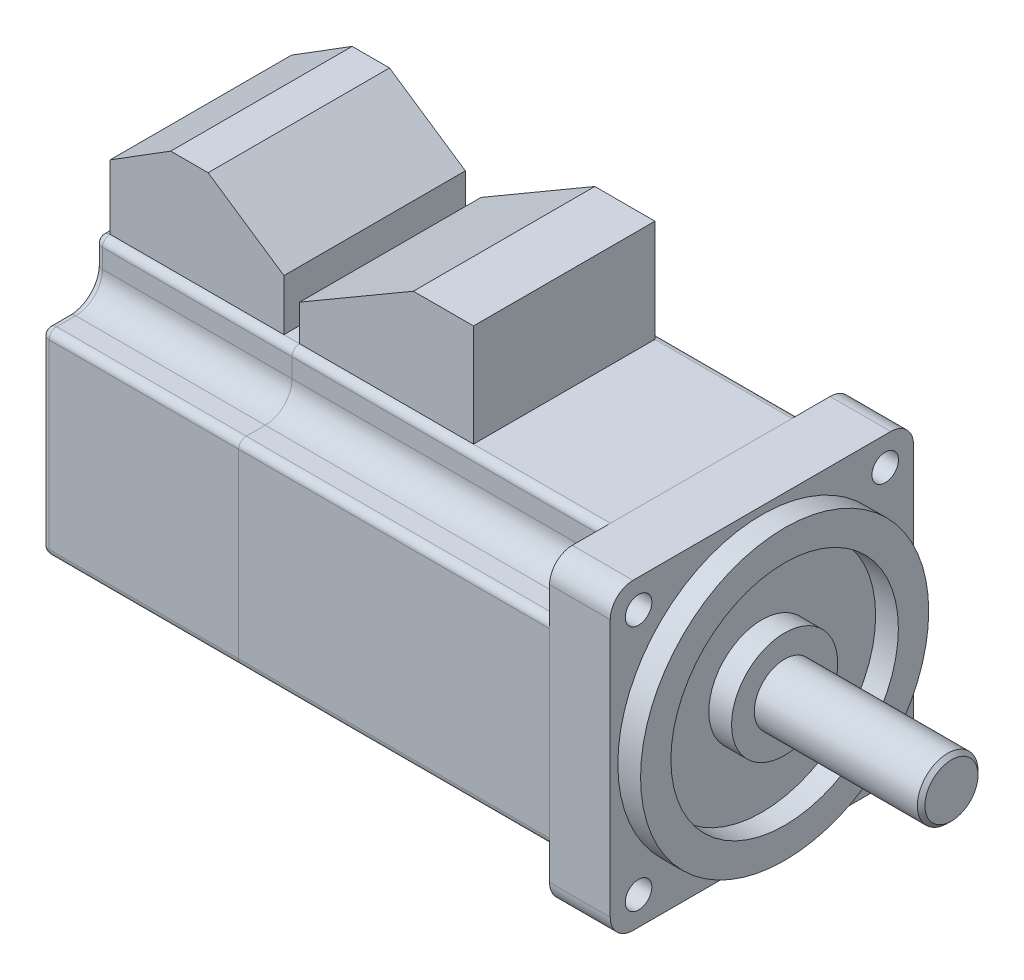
SolidWorks part; units mm, degrees
ref_plane "前视基准面" through (0, 0, 0) normal (0, 0, 1) x (1, 0, 0)
ref_plane "上视基准面" through (0, 0, 0) normal (0, 1, 0) x (1, 0, 0)
ref_plane "右视基准面" through (0, 0, 0) normal (1, 0, 0) x (0, 0, -1)
sketch "草图1" plane through (0, 0, 0) normal (1, 0, 0) x (0, 0, -1)
  line L1 (-17, -20) -> (17, -20)
  line L2 (-20, -17) -> (-20, 17)
  line L3 (-17, 20) -> (17, 20)
  line L4 (20, -17) -> (20, 17)
  line L5 (-20, -20) -> (20, 20) construction
  line L6 (-20, 20) -> (20, -20) construction
  arc A0 (-20, 17) -> (-17, 20) centre (-17, 17) cw
  arc A1 (-17, -20) -> (-20, -17) centre (-17, -17) cw
  arc A2 (17, -20) -> (20, -17) centre (17, -17) ccw
  arc A3 (17, 20) -> (20, 17) centre (17, 17) cw
  point P0 (0, 0)
  dimension "D1" = 3
extrude "凸台-拉伸1" add sketch "草图1" along normal blind 26
sketch "草图2" plane through (26, 0, 0) normal (1, 0, 0) x (0, 0, -1)
  line L0 (17, 20) -> (-17, 20) construction
  line L1 (-17, -20) -> (17, -20)
  line L2 (-20, -17) -> (-20, 17)
  line L3 (-17, 20) -> (17, 20)
  line L4 (20, -17) -> (20, 17)
  line L5 (-20, -20) -> (20, 20) construction
  line L6 (-20, 20) -> (20, -20) construction
  arc A0 (17, 20) -> (20, 17) centre (17, 17) cw
  arc A1 (17, -20) -> (20, -17) centre (17, -17) ccw
  arc A2 (-17, -20) -> (-20, -17) centre (-17, -17) cw
  arc A3 (-20, 17) -> (-17, 20) centre (-17, 17) cw
  point P0 (0, 0)
  dimension "D1" = 3
extrude "凸台-拉伸2" add sketch "草图2" along normal blind 41 separate body
sketch "草图3" plane through (67, 0, 0) normal (1, 0, 0) x (0, 0, -1)
  line L0 (17, 20) -> (-17, 20) construction
  line L1 (-17, -20) -> (17, -20)
  line L2 (-20, -17) -> (-20, 17)
  line L3 (-17, 20) -> (17, 20)
  line L4 (20, -17) -> (20, 17)
  line L5 (-20, -20) -> (20, 20) construction
  line L6 (-20, 20) -> (20, -20) construction
  arc A0 (17, 20) -> (20, 17) centre (17, 17) cw
  arc A1 (17, -20) -> (20, -17) centre (17, -17) ccw
  arc A2 (-17, -20) -> (-20, -17) centre (-17, -17) cw
  arc A3 (-20, 17) -> (-17, 20) centre (-17, 17) cw
  point P0 (0, 0)
  dimension "D1" = 3
extrude "凸台-拉伸3" add sketch "草图3" along normal blind 8 separate body
sketch "草图4" plane through (0, 0, 0) normal (-1, 0, 0) x (0, 0, 1)
  line L0 (-16.5, 12.9645) -> (-19, 12.9645)
  line L1 (-20, 11.9645) -> (-20, 17)
  line L3 (-17, 20) -> (-11.9645, 20)
  line L4 (11.9645, 20) -> (17, 20)
  line L6 (20, 17) -> (20, 11.9645)
  line L7 (-20, -17) -> (-20, 17) construction
  line L8 (20, -11.9645) -> (20, -17)
  line L9 (-19, -12.9645) -> (-16.5, -12.9645)
  line L11 (-12.9645, -16.5) -> (-12.9645, -19)
  line L12 (17, -20) -> (-17, -20) construction
  line L13 (17, -20) -> (11.9645, -20)
  line L14 (12.9645, -19) -> (12.9645, -16.5)
  line L15 (-11.9645, -20) -> (-17, -20)
  line L16 (16.5, -12.9645) -> (19, -12.9645)
  line L17 (20, 17) -> (20, -17) construction
  line L19 (19, 12.9645) -> (16.5, 12.9645)
  line L20 (-20, -17) -> (-20, -11.9645)
  line L21 (12.9645, 16.5) -> (12.9645, 19)
  line L22 (-17, 20) -> (17, 20) construction
  line L24 (-12.9645, 19) -> (-12.9645, 16.5)
  arc A0 (-16.5, 12.9645) -> (-12.9645, 16.5) centre (-16.5, 16.5) ccw
  arc A1 (12.9645, 16.5) -> (16.5, 12.9645) centre (16.5, 16.5) ccw
  arc A2 (16.5, -12.9645) -> (12.9645, -16.5) centre (16.5, -16.5) ccw
  arc A3 (-12.9645, -16.5) -> (-16.5, -12.9645) centre (-16.5, -16.5) ccw
  arc A4 (-11.9645, 20) -> (-12.9645, 19) centre (-11.9645, 19) ccw
  arc A5 (12.9645, 19) -> (11.9645, 20) centre (11.9645, 19) ccw
  arc A6 (20, 11.9645) -> (19, 12.9645) centre (19, 11.9645) ccw
  arc A7 (19, -12.9645) -> (20, -11.9645) centre (19, -11.9645) ccw
  arc A8 (11.9645, -20) -> (12.9645, -19) centre (11.9645, -19) ccw
  arc A9 (-12.9645, -19) -> (-11.9645, -20) centre (-11.9645, -19) ccw
  arc A10 (-19, 12.9645) -> (-20, 11.9645) centre (-19, 11.9645) ccw
  arc A11 (-20, -11.9645) -> (-19, -12.9645) centre (-19, -11.9645) ccw
  arc A12 (-20, -17) -> (-17, -20) centre (-17, -17) ccw
  arc A13 (17, -20) -> (20, -17) centre (17, -17) ccw
  arc A14 (20, 17) -> (17, 20) centre (17, 17) ccw
  arc A15 (-17, 20) -> (-20, 17) centre (-17, 17) ccw
  point P0 (0, 0)
  point P10 (-12.9645, 20)
  point P39 (12.9645, 20)
  point P42 (20, 12.9645)
  point P45 (20, -12.9645)
  point P48 (12.9645, -20)
  point P51 (-12.9645, -20)
  point P54 (-20, 12.9645)
  point P57 (-20, -12.9645)
  dimension "D1" = 1
extrude "切除-拉伸1" cut sketch "草图4" against normal blind 82
sketch "草图5" plane through (75, 0, 0) normal (1, 0, 0) x (0, 0, -1)
  circle A2 centre (-16.2635, 16.2635) radius 1.75
  circle A3 centre (16.2635, 16.2635) radius 1.75
  circle A4 centre (16.2635, -16.2635) radius 1.75
  circle A5 centre (-16.2635, -16.2635) radius 1.75
extrude "切除-拉伸2" cut sketch "草图5" against normal blind 8
fillet "圆角1" radius 1 24 edges at (0, 20, 0) (0, 19.7071, 12.6716) (0, 17.75, 12.9645) (0, 14, 14) (0, 12.9645, 17.75) (0, 12.6716, 19.7071) (0, 0, 20) (0, -12.6716, 19.7071) (0, -12.9645, 17.75) (0, -14, 14) (0, -17.75, 12.9645) (0, -19.7071, 12.6716) (0, -20, 0) (0, -19.7071, -12.6716) (0, -17.75, -12.9645) (0, -14, -14) (0, -12.9645, -17.75) (0, -12.6716, -19.7071) (0, 0, -20) (0, 12.6716, -19.7071) (0, 12.9645, -17.75) (0, 14, -14) (0, 17.75, -12.9645) (0, 19.7071, -12.6716)
sketch "草图6" plane through (75, 0, 0) normal (1, 0, 0) x (0, 0, -1)
  circle A0 centre (0, 0) radius 19
  circle A1 centre (0, 0) radius 15
  circle A2 centre (0, 0) radius 7
extrude "凸台-拉伸4" add sketch "草图6" along normal blind 3 contours A0 A1 | A2
sketch "草图7" plane through (78, 0, 0) normal (1, 0, 0) x (0, 0, -1)
  circle A0 centre (0, 0) radius 4
extrude "凸台-拉伸5" add sketch "草图7" along normal blind 22 separate body
chamfer "倒角1" distance 0.5 angle 45 1 edges at (100, 0, -4)
sketch "草图12" plane through (0, 20, 0) normal (0, 1, 0) x (1, 0, 0)
  line L0 (26, 11.9645) -> (48.93, 11.9645)
  line L1 (1, 11.9645) -> (23.93, 11.9645)
  line L2 (26, 11.9645) -> (1, 11.9645) construction
  line L3 (23.93, -11.9645) -> (1, -11.9645)
  line L4 (26, -11.9645) -> (1, -11.9645) construction
  line L5 (23.93, 11.9645) -> (23.93, -11.9645)
  line L6 (1, 11.9645) -> (1, -11.9645)
  line L7 (67, 11.9645) -> (26, 11.9645) construction
  line L8 (48.93, 11.9645) -> (48.93, -11.9645)
  line L9 (67, -11.9645) -> (26, -11.9645) construction
  line L10 (48.93, -11.9645) -> (26, -11.9645)
  line L11 (26, -11.9645) -> (26, 11.9645)
extrude "凸台-拉伸6" add sketch "草图12" along normal blind 13.5 separate body
sketch "草图13" plane through (0, 0, 11.9645) normal (0, 0, 1) x (1, 0, 0)
  line L0 (1, 33.5) -> (1, 28.5)
  line L1 (1, 33.5) -> (9, 33.5)
  line L2 (1, 33.5) -> (23.93, 33.5) construction
  line L3 (23.93, 33.5) -> (13.93, 33.5)
  line L4 (23.93, 33.5) -> (23.93, 26.75)
  line L5 (23.93, 33.5) -> (23.93, 20) construction
  line L6 (23.93, 26.75) -> (13.93, 33.5)
  line L7 (26, 33.5) -> (41, 33.5)
  line L8 (26, 33.5) -> (48.93, 33.5) construction
  line L9 (26, 33.5) -> (26, 24.7508)
  line L10 (26, 33.5) -> (26, 20) construction
  line L11 (26, 24.7508) -> (41, 33.5)
  line L12 (9, 33.5) -> (1, 28.5)
extrude "切除-拉伸3" cut sketch "草图13" against normal blind 23.93
